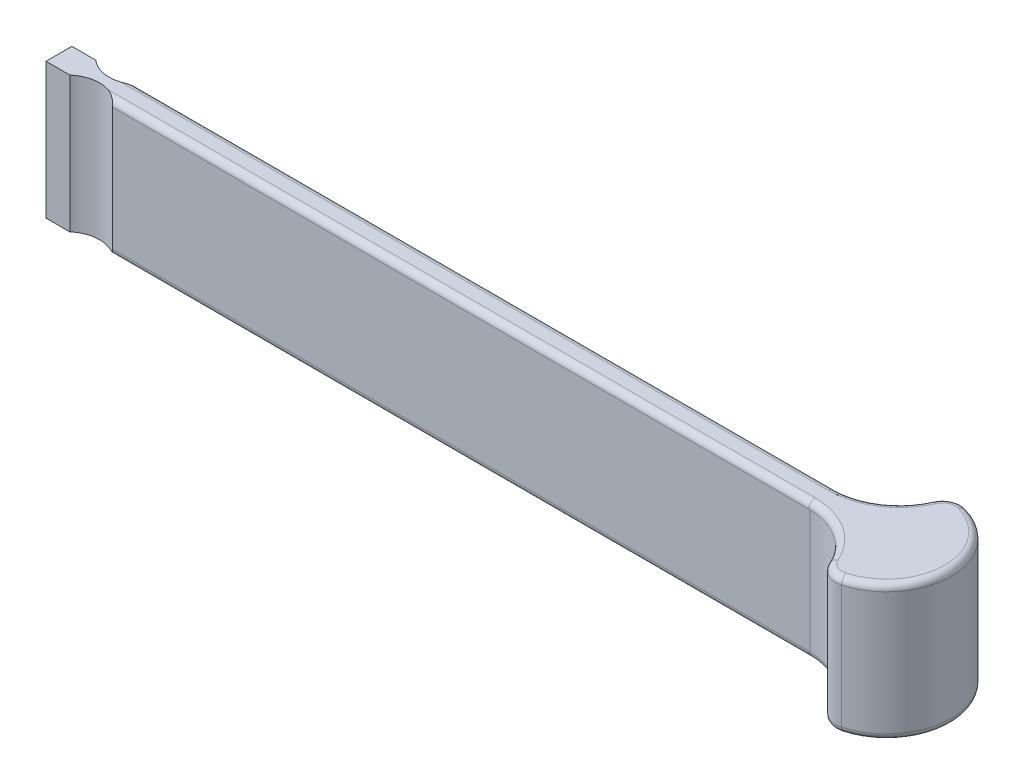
SolidWorks part; units mm, degrees
ref_plane "Front Plane" through (0, 0, 0) normal (0, 0, 1) x (1, 0, 0)
ref_plane "Top Plane" through (0, 0, 0) normal (0, 1, 0) x (1, 0, 0)
ref_plane "Right Plane" through (0, 0, 0) normal (1, 0, 0) x (0, 0, -1)
sketch "Sketch1" plane through (0, 0, 0) normal (0, 0, 1) x (1, 0, 0)
  line L1 (-150, 10.5) -> (150, 10.5)
  line L2 (-150, 10.5) -> (-150, -10.5)
  line L3 (-150, -10.5) -> (150, -10.5)
  line L4 (150, 10.5) -> (150, -10.5)
  line L5 (-150, 10.5) -> (150, -10.5) construction
  line L6 (-150, -10.5) -> (150, 10.5) construction
  point P0 (0, 0)
  dimension "D1" = 21
  dimension "D2" = 300
extrude "Boss-Extrude1" add sketch "Sketch1" along normal blind 4
sketch "Sketch2" plane through (0, 10.5, 0) normal (0, 1, 0) x (1, 0, 0)
  line L0 (-150, -4) -> (-150, -38)
  line L1 (-150, -38) -> (-168, -38)
  line L2 (-168, -38) -> (-168, 0)
  line L3 (-168, 0) -> (-150, 0)
  line L4 (-150, 0) -> (-150, -4)
  line L5 (-154, -9) -> (-154, -29)
  line L6 (-164, -29) -> (-164, -9)
  arc A0 (-154, -9) -> (-164, -9) centre (-159, -9) ccw
  arc A1 (-164, -29) -> (-154, -29) centre (-159, -29) ccw
  dimension "D3" = 10
  dimension "D1" = 5
  dimension "D6" = 9
  dimension "D7" = 9
  dimension "D4" = 10
  dimension "D2" = 25
  dimension "D5" = 9
  dimension "D8" = 9
extrude "Boss-Extrude2" add sketch "Sketch2" against normal up to surface (21 mm away)
fillet "Fillet2" radius 10 1 edges
fillet "Fillet3" radius 5 3 edges at (-150, 0, 38) (-168, 0, 38) (-168, 0, 0)
sketch "Sketch3" plane through (0, 0, 0) normal (0, 0, -1) x (-1, 0, 0)
  line L0 (-150, 10.5) -> (163, 10.5) construction
  line L1 (-150, -10.5) -> (-56.63, -10.5)
  line L2 (-150, -10.5) -> (-150, 10.5)
  line L3 (-150, 10.5) -> (-56.63, 10.5)
  line L4 (-56.63, -10.5) -> (-56.63, 10.5)
  dimension "D1" = 93.37
extrude "Cut-Extrude1" cut sketch "Sketch3" against normal blind 10
sketch "Sketch4" plane through (0, 10.5, 0) normal (0, 1, 0) x (1, 0, 0)
  line L0 (56.63, -2) -> (100.9468, -2) construction
  line L1 (56.63, -4) -> (56.63, 0) construction
  line L2 (56.63, 0) -> (73.2204, 0)
  line L3 (56.63, -4) -> (73.2204, -4)
  line L4 (56.63, 0) -> (56.63, -4)
  arc A0 (73.2208, 0.002) -> (73.2204, 0) centre (83.0184, -2) ccw
  arc A1 (73.0184, 0) -> (82.8159, 7.998) centre (73.0184, 10) ccw
  arc A2 (73.0184, -4) -> (82.8159, -11.998) centre (73.0184, -14) cw
  arc A3 (82.8159, -11.998) -> (82.8159, 7.998) centre (83.0184, -2) ccw
  arc A4 (73.2204, -4) -> (73.2208, -4.002) centre (83.0184, -2) ccw
  dimension "D1" = 20
  dimension "D2" = 20
  dimension "D3" = 10
  dimension "D4" = 10
extrude "Boss-Extrude3" add sketch "Sketch4" against normal up to surface (21 mm away) contours L0 L3 A4 A2 A3 M4 | L4 L0 A3 A1 A0 L2
sketch "Sketch5" plane through (0, 0, 0) normal (0, 0, -1) x (-1, 0, 0)
  line L0 (44.8898, -10.5) -> (44.8898, 10.5) construction
  line L1 (163, -10.5) -> (-73.2204, -10.5) construction
  line L2 (-73.2204, 10.5) -> (163, 10.5) construction
  line L4 (44.8898, -10.5) -> (197.31, -10.5)
  line L5 (44.8898, -10.5) -> (44.8898, 42.7168)
  line L6 (44.8898, 42.7168) -> (197.31, 42.7168)
  line L7 (197.31, -10.5) -> (197.31, 42.7168)
extrude "Cut-Extrude2" cut sketch "Sketch5" against normal through all
sketch "Sketch6" plane through (0, 10.5, 0) normal (0, 1, 0) x (1, 0, 0)
  line L0 (-44.8898, -2) -> (-26.011, -2) construction
  line L1 (-44.8898, 0) -> (-44.8898, -4) construction
  circle A0 centre (-37.8898, 3.75) radius 5
  circle A1 centre (-37.8898, -7.75) radius 5
  dimension "D1" = 10
  dimension "D2" = 5.75
  dimension "D3" = 7
extrude "Cut-Extrude3" cut sketch "Sketch6" against normal through all
fillet "Fillet4" radius 3 2 edges at (82.8159, 0, 11.998) (82.8159, 0, -7.998)
fillet "Fillet5" radius 1 18 edges at (19.3189, -10.5, 0) (78.5592, -10.5, 5.6754) (93.0184, 10.5, 2) (83.6276, 10.5, -7.454) (83.6276, 10.5, 11.454) (93.0184, -10.5, 2) (78.5592, -10.5, -1.6754) (83.6276, -10.5, -7.454) (83.6276, -10.5, 11.454) (19.3189, 10.5, 0) (73.2206, 10.5, -0.001) (73.2206, 10.5, 4.001) (78.5592, 10.5, 5.6754) (78.5592, 10.5, -1.6754) (73.2206, -10.5, 4.001) (73.2206, -10.5, -0.001)
